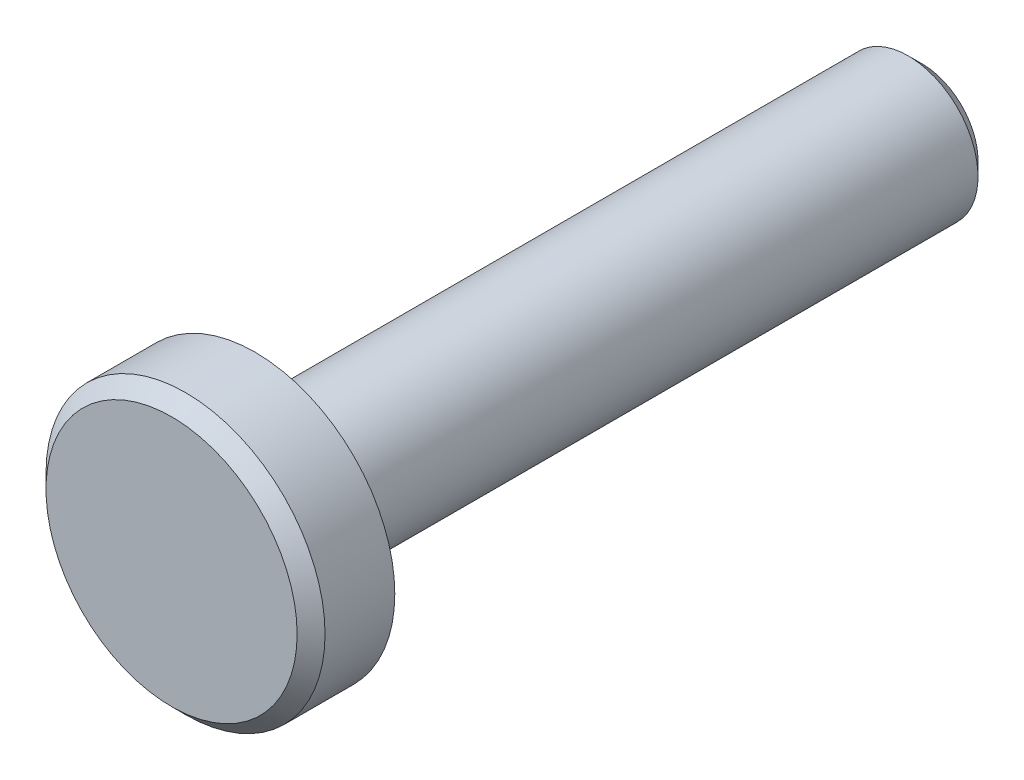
SolidWorks part; units mm, degrees
ref_plane "XZ (Face)" through (0, 0, 0) normal (0, 0, 1) x (1, 0, 0)
ref_plane "XY (Dessus)" through (0, 0, 0) normal (0, 1, 0) x (1, 0, 0)
ref_plane "YZ (Droite)" through (0, 0, 0) normal (1, 0, 0) x (0, 0, -1)
sketch "Esquisse1" plane through (0, 0, 0) normal (0, 0, 1) x (1, 0, 0)
  circle A0 centre (-4.2131, -17.5) radius 1.25 construction
  circle A1 centre (-4.2131, -17.5) radius 1.25
extrude "Base-Extrusion" add sketch "Esquisse1" along normal blind 5.7 and the other way up to surface
sketch "Esquisse2" plane through (0, 0, 5.7) normal (0, 0, 1) x (1, 0, 0)
  circle A2 centre (-4.2131, -17.5) radius 2.5
  circle A3 centre (-4.2131, -17.5) radius 2.5
  dimension "D1" = 1.25
extrude "Boss.-Extru.1" add sketch "Esquisse2" along normal blind 1.5
chamfer "Chanfrein1" distance 0.25 angle 45
